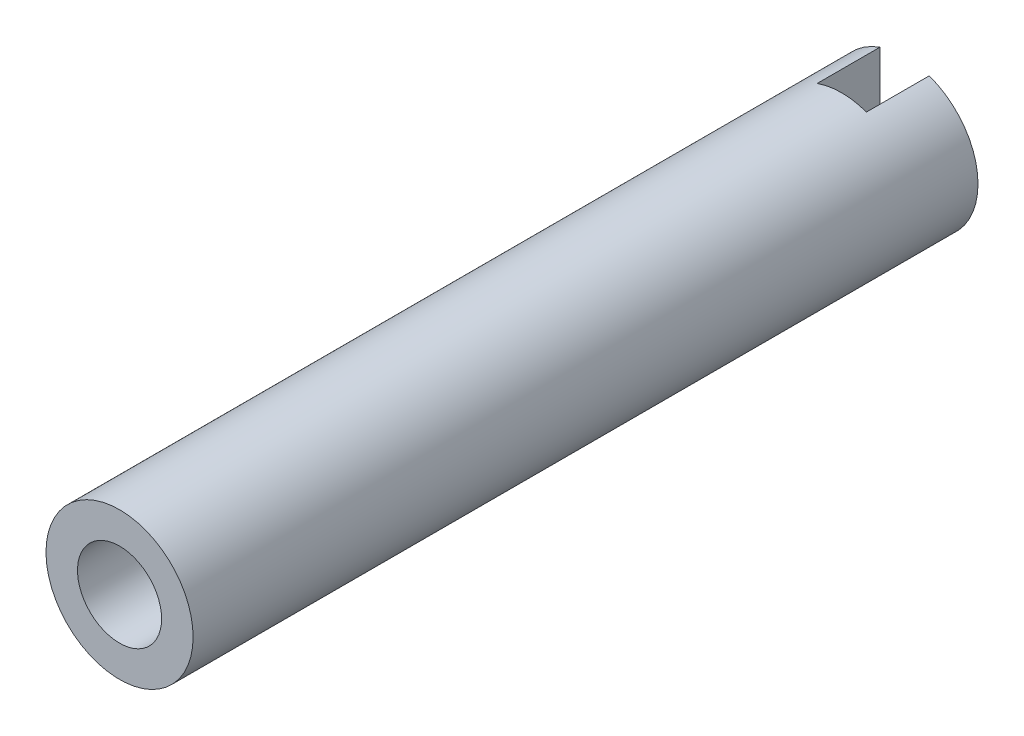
SolidWorks part; units mm, degrees
ref_plane "Front Plane" through (0, 0, 0) normal (0, 0, 1) x (1, 0, 0)
ref_plane "Top Plane" through (0, 0, 0) normal (0, 1, 0) x (1, 0, 0)
ref_plane "Right Plane" through (0, 0, 0) normal (1, 0, 0) x (0, 0, -1)
sketch "Sketch1" plane through (0, 0, 0) normal (0, 0, 1) x (1, 0, 0)
  circle A0 centre (0, 0) radius 2.0828
  dimension "D1" = 4.1656
extrude "Boss-Extrude1" add sketch "Sketch1" along normal blind 22.225
sketch "Sketch3" plane through (0, 0, 0) normal (0, 0, -1) x (-1, 0, 0)
  line L1 (-0.7028, -2.1516) -> (0.6942, -2.1516)
  line L2 (-0.7028, -2.1516) -> (-0.7028, 2.1516)
  line L3 (-0.7028, 2.1516) -> (0.6942, 2.1516)
  line L4 (0.6942, -2.1516) -> (0.6942, 2.1516)
  line L5 (-0.7028, -2.1516) -> (0.6942, 2.1516) construction
  line L6 (-0.7028, 2.1516) -> (0.6942, -2.1516) construction
  point P0 (-0.0043, 0)
  dimension "D1" = 1.397
extrude "Cut-Extrude1" cut sketch "Sketch3" against normal blind 1.778
sketch "Sketch4" plane through (0, 0, 22.225) normal (0, 0, 1) x (1, 0, 0)
  circle A0 centre (0, 0) radius 1.1906
  dimension "D1" = 2.3813
extrude "Cut-Extrude3" cut sketch "Sketch4" against normal blind 3.175 contours A0
chamfer "Chamfer1" distance 1.1906 angle 45 1 edges at (1.1906, 0, 19.05)
